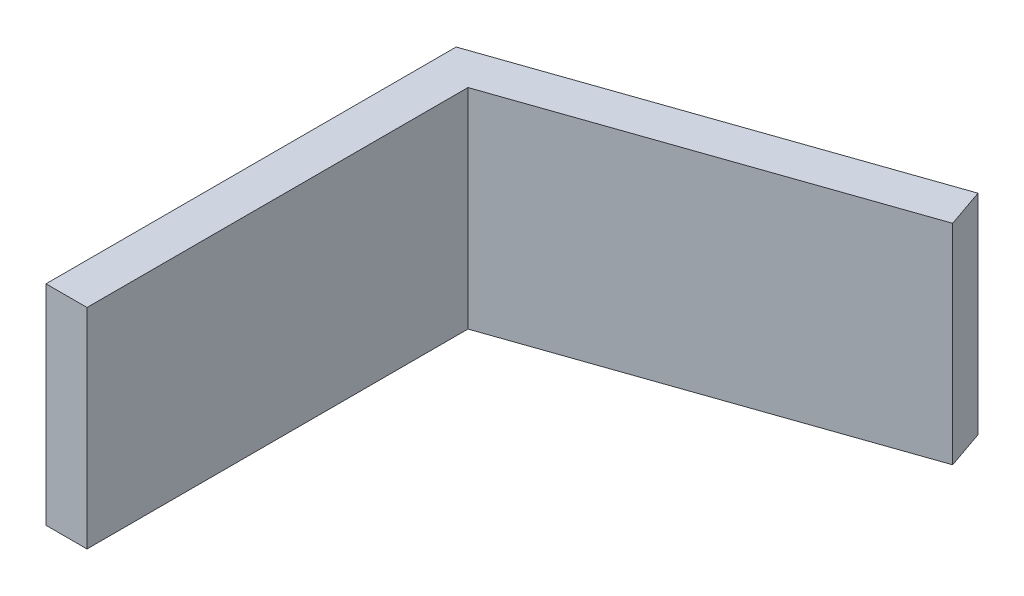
SolidWorks part; units mm, degrees
ref_plane "Alzado" through (0, 0, 0) normal (0, 0, 1) x (1, 0, 0)
ref_plane "Planta" through (0, 0, 0) normal (0, 1, 0) x (1, 0, 0)
ref_plane "Vista lateral" through (0, 0, 0) normal (1, 0, 0) x (0, 0, -1)
sketch "Croquis1" plane through (0, 0, 0) normal (0, 1, 0) x (1, 0, 0)
  line L0 (-5, 91.1176) -> (-5, -8.8824)
  line L1 (5, 84.0004) -> (5, -8.8824)
  line L2 (0, 0) -> (0, 14.5829) construction
  line L3 (-5, -8.8824) -> (23.8819, -8.8824) construction
  line L4 (-5, 91.1176) -> (89.4836, 123.8719)
  line L5 (-5, 91.1176) -> (40.075, 91.1176) construction
  line L6 (5, 84.0004) -> (92.7591, 114.4236)
  line L7 (89.4836, 123.8719) -> (101.5309, 89.1202) construction
  line L8 (-5, -8.8824) -> (5, -8.8824)
  line L9 (89.4836, 123.8719) -> (92.7591, 114.4236)
  point P13 (48.8795, 99.212)
  dimension "D1" = 5
  dimension "D2" = 100
  dimension "D4" = 19.12
  dimension "D5" = 10
  dimension "D6" = 100
extrude "Saliente-Extruir1" add sketch "Croquis1" along normal mid plane 51
